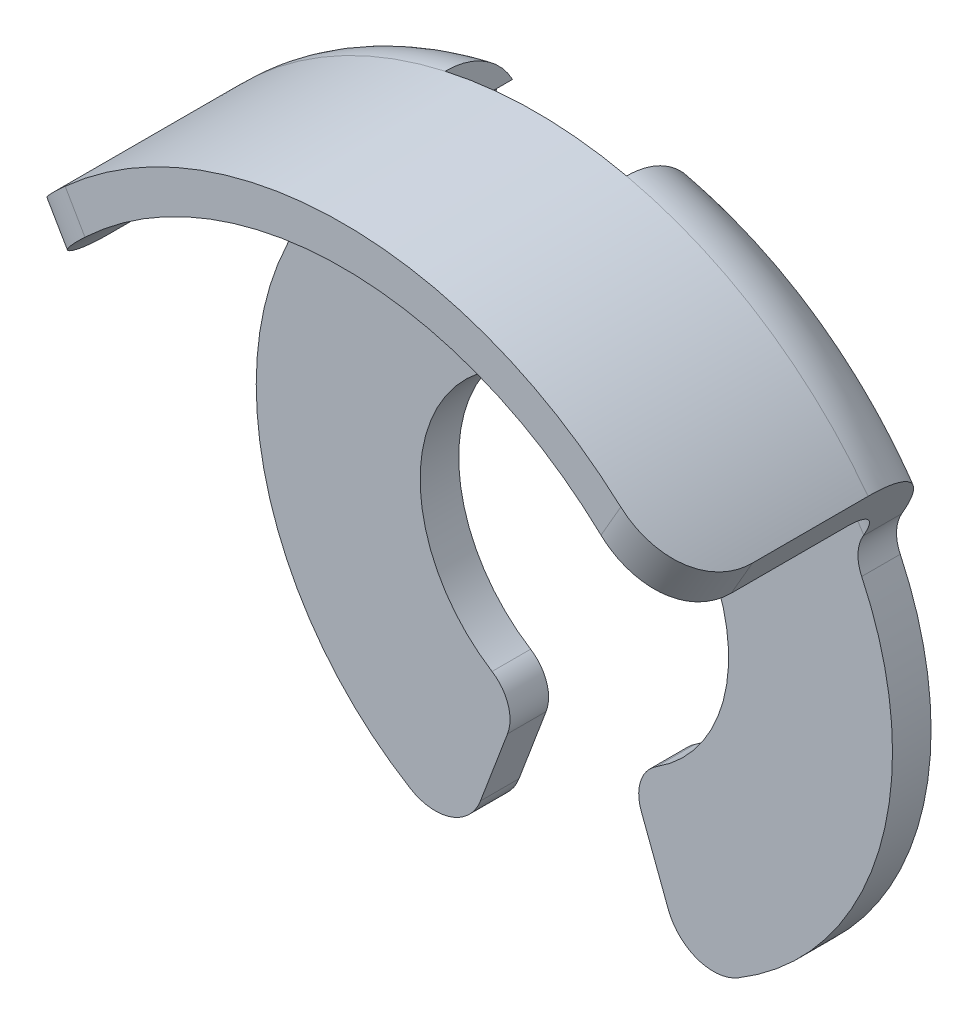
SolidWorks part; units mm, degrees
ref_plane "Front Plane" through (0, 0, 0) normal (0, 0, 1) x (1, 0, 0)
ref_plane "Top Plane" through (0, 0, 0) normal (0, 1, 0) x (1, 0, 0)
ref_plane "Right Plane" through (0, 0, 0) normal (1, 0, 0) x (0, 0, -1)
sketch "Sketch1" plane through (0, 0, 0) normal (0, 0, 1) x (1, 0, 0)
  circle A0 centre (0, 0) radius 1.6
  circle A1 centre (0, 0) radius 4.3
  dimension "D1" = 3.2
  dimension "D2" = 8.6
extrude "Boss-Extrude1" add sketch "Sketch1" against normal blind 2.8
sketch "Sketch2" plane through (0, 0, 0) normal (0, 0, 1) x (1, 0, 0)
  circle A0 centre (0, 0) radius 3.9
  dimension "D1" = 7.8
extrude "Cut-Extrude1" cut sketch "Sketch2" against normal blind 2.4
sketch "Sketch3" plane through (0, 0, 0) normal (0, 0, 1) x (1, 0, 0)
  line L0 (-3.4468, 2.571) -> (-2.8862, 1.6)
  line L1 (3.4468, 2.571) -> (2.8862, 1.6)
  circle A0 centre (0, 0) radius 4.3 construction
  arc A1 (-2.8862, 1.6) -> (2.8862, 1.6) centre (0, 0) ccw
  circle A2 centre (0, 0) radius 1.6 construction
  arc A4 (-3.4468, 2.571) -> (3.4468, 2.571) centre (0, 0) ccw
  point P7 (-3.3, 0)
  point P9 (3.3, 0)
  point P10 (0, 1.6)
  dimension "D1" = 60
  dimension "D2" = 6.6
extrude "Cut-Extrude2" cut sketch "Sketch3" against normal through all
sketch "Sketch4" plane through (0, 0, -2.4) normal (0, 0, 1) x (1, 0, 0)
  line L0 (0, 0) -> (-0.566, -1.4966) construction
  line L1 (0, 0) -> (0.566, -1.4966) construction
  line L2 (-0.566, 1.4966) -> (-1.1896, 3.1456)
  line L3 (0, 0) -> (-0.566, 1.4966) construction
  line L4 (0, 0) -> (0.566, 1.4966) construction
  line L5 (1.1896, 3.1456) -> (0.566, 1.4966)
  line L6 (0.566, 1.4966) -> (0.566, -1.4966) construction
  line L7 (-0.566, 1.4966) -> (-0.566, -1.4966) construction
  line L8 (-0.566, -1.4966) -> (-0.9745, -2.5769)
  line L9 (0.566, -1.4966) -> (0.9745, -2.5769)
  arc A0 (0.8281, 3.8111) -> (-0.8281, 3.8111) centre (0, 0) ccw
  arc A1 (3.2269, 2.1902) -> (-3.2269, 2.1902) centre (0, 0) ccw construction
  arc A2 (-0.566, 1.4966) -> (-0.566, -1.4966) centre (0, 0) ccw
  circle A3 centre (0, 0) radius 1.6 construction
  arc A4 (-1.1896, 3.1456) -> (-0.8281, 3.8111) centre (-0.722, 3.3225) cw
  arc A6 (0.8281, 3.8111) -> (1.1896, 3.1456) centre (0.722, 3.3225) cw
  arc A7 (-0.9745, -2.5769) -> (-1.6998, -2.8286) centre (-1.4422, -2.4) cw
  arc A8 (-2.8862, 1.6) -> (2.8862, 1.6) centre (0, 0) ccw construction
  arc A9 (0.9745, -2.5769) -> (1.6998, -2.8286) centre (1.4422, -2.4) ccw
  arc A10 (1.6998, -2.8286) -> (-1.6998, -2.8286) centre (0, 0) cw
  arc A11 (3.4468, 2.571) -> (-3.4468, 2.571) centre (0, 0) ccw construction
  arc A12 (0.566, -1.4966) -> (0.566, 1.4966) centre (0, 0) ccw
  point P1 (-1.4422, -2.9)
  point P30 (1.4422, -2.9)
  point P31 (0, 4.3)
  dimension "D2" = 0.5
  dimension "D1" = 7.2
extrude "Cut-Extrude3" cut sketch "Sketch4" against normal up to vertex
fillet "Fillet1" radius 0.8 3 edges at (0, 4.3, -2.8) (3.3368, 2.3806, 0) (-3.3368, 2.3806, 0)
fillet "Fillet2" radius 0.4 8 edges at (2.1835, 3.2315, -2.4) (-2.1835, 3.2315, -2.4) (-0.566, -1.4966, -2.6) (0.566, -1.4966, -2.6) (-0.566, 1.4966, -2.6) (0.566, 1.4966, -2.6) (-2.8862, 1.6, -2.6) (2.8862, 1.6, -2.6)
sketch "Sketch5" plane through (0, -4.5, -2.8) normal (0, 0, 1) x (1, 0, 0)
  line L0 (-0.9414, 6.9892) -> (-0.9414, 8.8)
  line L5 (0.9414, 6.9892) -> (0.9414, 8.8)
  line L6 (0.9414, 6.9892) -> (-0.9414, 6.9892)
  line L7 (0.6932, 6.3329) -> (1.1896, 7.6456) construction
  line L8 (-1.1896, 7.6456) -> (-0.6932, 6.3329) construction
  line L10 (-0.9414, 8.8) -> (0.9414, 8.8)
  arc A0 (3.4468, 7.071) -> (-3.4468, 7.071) centre (0, 4.5) ccw construction
extrude "Cut-Extrude5" cut sketch "Sketch5" along normal blind 0.8
